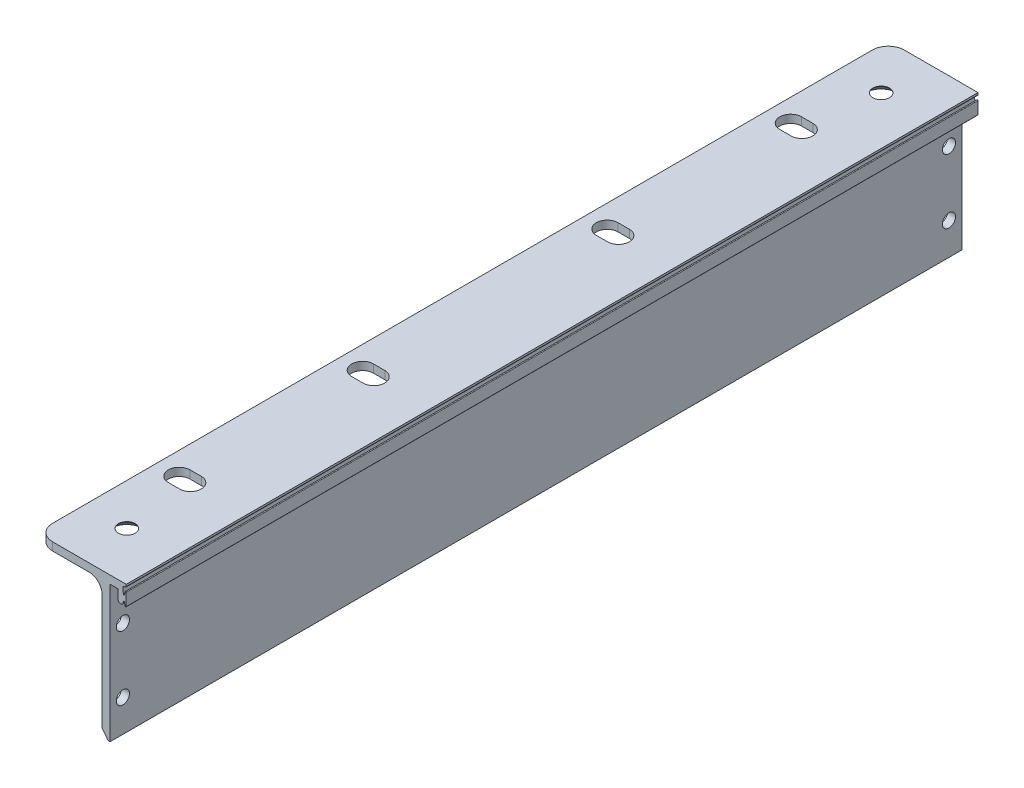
SolidWorks part; units mm, degrees
ref_plane "前视基准面" through (0, 0, 0) normal (0, 0, 1) x (1, 0, 0)
ref_plane "上视基准面" through (0, 0, 0) normal (0, 1, 0) x (1, 0, 0)
ref_plane "右视基准面" through (0, 0, 0) normal (1, 0, 0) x (0, 0, -1)
sketch "草图1" plane through (0, 0, 0) normal (0, 0, 1) x (1, 0, 0)
  line L1 (2137.4351, -3066.2715) -> (2137.4351, -3069.1377)
  line L2 (2139.9751, -3063.7715) -> (2139.9751, -3064.3461)
  line L886 (2138.9752, -3069.3427) -> (2139.1203, -3068.8072)
  line L887 (2137.4351, -3066.2715) -> (2137.4351, -3069.1377)
  line L888 (2134.9351, -3066.2715) -> (2137.4351, -3066.2715)
  line L889 (2139.4107, -3068.8105) -> (2139.6548, -3069.798)
  line L890 (2134.9351, -3066.2715) -> (2134.9351, -3108.7715)
  line L891 (2134.9351, -3108.7715) -> (2134.3351, -3108.7715)
  line L892 (2139.9751, -3065.934) -> (2139.9751, -3069.759)
  line L893 (2132.4351, -3106.2715) -> (2134.3351, -3108.7715)
  line L894 (2132.4351, -3070.2715) -> (2132.4351, -3106.2715)
  line L895 (2139.4107, -3066.8825) -> (2139.6548, -3065.895)
  line L896 (2112.0351, -3066.2715) -> (2128.4351, -3066.2715)
  line L897 (2112.0351, -3063.7715) -> (2112.0351, -3066.2715)
  line L898 (2112.0351, -3063.7715) -> (2139.9751, -3063.7715)
  line L899 (2139.9751, -3063.7715) -> (2139.9751, -3064.3461)
  line L900 (2139.174, -3064.7312) -> (2139.723, -3064.6423)
  arc A123 (2137.4351, -3069.1377) -> (2138.9752, -3069.3427) centre (2138.2188, -3069.1377) ccw
  arc A124 (2139.4107, -3068.8105) -> (2139.1203, -3068.8072) centre (2139.2651, -3068.8465) ccw
  arc A125 (2139.6548, -3069.798) -> (2139.9751, -3069.759) centre (2139.8126, -3069.759) ccw
  arc A126 (2139.9751, -3065.934) -> (2139.6548, -3065.895) centre (2139.8126, -3065.934) ccw
  arc A127 (2139.1161, -3066.864) -> (2139.4107, -3066.8825) centre (2139.2651, -3066.8465) ccw
  arc A128 (2138.9221, -3065.0153) -> (2139.1161, -3066.864) centre (2145.3632, -3065.274) ccw
  arc A129 (2139.174, -3064.7312) -> (2138.9221, -3065.0153) centre (2139.2219, -3065.0273) ccw
  arc A130 (2139.723, -3064.6423) -> (2139.9751, -3064.3461) centre (2139.6751, -3064.3461) ccw
  arc A131 (2132.4351, -3070.2715) -> (2128.4351, -3066.2715) centre (2128.4351, -3070.2715) ccw
extrude "凸台-拉伸1" add sketch "草图1" along normal mid plane 265.35 contours A131 L894 L893 L891 L890 L888 L1 A123 L886 A124 L889 A125 L892 A126 L895 A127 A128 A129 L900 A130 L2 L898 L897 L896
sketch "草图8" plane through (2132.4351, 0, 0) normal (-1, 0, 0) x (0, 0, 1)
  line L0 (-132.675, -3070.2715) -> (-132.675, -3106.2715) construction
  line L1 (132.675, -3063.7715) -> (-132.675, -3063.7715) construction
  line L2 (0, -3106.2715) -> (0, -3066.2715) construction
  line L3 (132.675, -3106.2715) -> (-132.675, -3106.2715) construction
  line L4 (132.675, -3066.2715) -> (-132.675, -3066.2715) construction
  circle A0 centre (-128.675, -3078.7715) radius 2.05
  circle A1 centre (-128.675, -3098.7715) radius 2.05
  circle A2 centre (128.675, -3098.7715) radius 2.05
  circle A3 centre (128.675, -3078.7715) radius 2.05
  dimension "D1" = 4.1
  dimension "D2" = 4.1
  dimension "D3" = 4
  dimension "D4" = 20
  dimension "D5" = 4
  dimension "D6" = 15
extrude "切除-拉伸7" cut sketch "草图8" against normal blind 132
sketch "草图4" plane through (0, -3063.7715, 0) normal (0, 1, 0) x (1, 0, 0)
  line L0 (2119.0351, 95.25) -> (2122.5351, 95.25) construction
  line L1 (2112.0351, 132.675) -> (2139.9751, 132.675) construction
  line L2 (2119.0351, 98.65) -> (2122.5351, 98.65)
  line L3 (2119.0351, 91.85) -> (2122.5351, 91.85)
  line L4 (2112.0351, -132.675) -> (2112.0351, 132.675) construction
  line L5 (2139.9751, 0) -> (2112.0351, 0) construction
  line L6 (2139.9751, -132.675) -> (2139.9751, 132.675) construction
  line L7 (2119.0351, -95.25) -> (2122.5351, -95.25) construction
  line L8 (2119.0351, -98.65) -> (2122.5351, -98.65)
  line L9 (2119.0351, -91.85) -> (2122.5351, -91.85)
  arc A0 (2119.0351, 98.65) -> (2119.0351, 91.85) centre (2119.0351, 95.25) ccw
  arc A1 (2122.5351, 91.85) -> (2122.5351, 98.65) centre (2122.5351, 95.25) ccw
  arc A2 (2119.0351, -98.65) -> (2119.0351, -91.85) centre (2119.0351, -95.25) cw
  arc A3 (2122.5351, -91.85) -> (2122.5351, -98.65) centre (2122.5351, -95.25) cw
  point P4 (2120.7851, 95.25)
  point P17 (2120.7851, -95.25)
  dimension "D1" = 3.4
  dimension "D3" = 37.425
  dimension "D2" = 3.5
  dimension "D4" = 8.75
extrude "切除-拉伸2" cut sketch "草图4" against normal blind 132
sketch "草图7" plane through (0, -3063.7715, 0) normal (0, 1, 0) x (1, 0, 0)
  line L1 (2112.0351, -132.675) -> (2112.0351, 132.675) construction
  line L2 (2139.9751, 0) -> (2112.0351, 0) construction
  line L3 (2139.9751, -132.675) -> (2139.9751, 132.675) construction
  line L4 (2119.0351, 38.1) -> (2122.5351, 38.1) construction
  line L5 (2119.0351, -38.1) -> (2122.5351, -38.1) construction
  line L6 (2119.0351, 41.5) -> (2122.5351, 41.5)
  line L7 (2119.0351, 34.7) -> (2122.5351, 34.7)
  line L8 (2119.0351, -41.5) -> (2122.5351, -41.5)
  line L9 (2119.0351, -34.7) -> (2122.5351, -34.7)
  arc A2 (2119.0351, 41.5) -> (2119.0351, 34.7) centre (2119.0351, 38.1) ccw
  arc A3 (2122.5351, 34.7) -> (2122.5351, 41.5) centre (2122.5351, 38.1) ccw
  arc A4 (2119.0351, 98.65) -> (2119.0351, 91.85) centre (2119.0351, 95.25) ccw construction
  arc A5 (2119.0351, -41.5) -> (2119.0351, -34.7) centre (2119.0351, -38.1) cw
  arc A6 (2122.5351, -34.7) -> (2122.5351, -41.5) centre (2122.5351, -38.1) cw
  point P16 (2120.7851, 38.1)
  point P24 (2120.7851, -38.1)
  dimension "D4" = 3.4
  dimension "D6" = 57.15
  dimension "D7" = 3.5
  dimension "D5" = 8.75
extrude "切除-拉伸6" cut sketch "草图7" against normal blind 132
sketch "草图9" plane through (2132.4351, 0, 0) normal (-1, 0, 0) x (0, 0, 1)
  line L0 (-132.675, -3070.2715) -> (-132.675, -3106.2715) construction
  line L1 (132.675, -3063.7715) -> (-132.675, -3063.7715) construction
  circle A0 centre (-4.675, -3078.7715) radius 2.05
  circle A1 centre (4.675, -3078.7715) radius 2.05
  circle A2 centre (4.675, -3098.7715) radius 2.05
  circle A3 centre (-4.675, -3098.7715) radius 2.05
  dimension "D1" = 4.1
  dimension "D2" = 128
  dimension "D3" = 15
  dimension "D4" = 2
  dimension "D5" = 2
extrude "切除-拉伸8" cut sketch "草图9" against normal blind 132
fillet "圆角1" radius 5 2 edges at (2112.0351, -3065.0215, -132.675) (2112.0351, -3065.0215, 132.675)
sketch "草图11" plane through (0, -3063.7715, 0) normal (0, 1, 0) x (1, 0, 0)
  line L0 (2112.0351, -127.675) -> (2112.0351, 127.675) construction
  line L1 (2117.0351, 132.675) -> (2139.9751, 132.675) construction
  line L2 (2139.9751, 0) -> (2112.0351, 0) construction
  line L3 (2139.9751, -132.675) -> (2139.9751, 132.675) construction
  circle A0 centre (2122.0351, 111.175) radius 2.1
  circle A1 centre (2122.0351, -111.175) radius 2.1
  point P4 (2128.5051, 132.675)
  dimension "D1" = 4.2
  dimension "D2" = 10
  dimension "D3" = 21.5
extrude "切除-拉伸10" [suppressed] cut sketch "草图11" against normal through all
sketch "草图12" plane through (2132.4351, 0, 0) normal (-1, 0, 0) x (0, 0, 1)
  line L1 (10.9556, -3073.8244) -> (-12.9495, -3073.8244)
  line L2 (10.9556, -3073.8244) -> (10.9556, -3102.903)
  line L3 (10.9556, -3102.903) -> (-12.9495, -3102.903)
  line L4 (-12.9495, -3073.8244) -> (-12.9495, -3102.903)
extrude "凸台-拉伸2" add sketch "草图12" against normal up to surface (2.5 mm away)
hole_wizard "Ø5.2 (5.2) 直径孔1" positions "草图14" profile "草图13" hole size "Ø5.2" standard "Ansi Metric"
sketch "草图14" plane through (0, -3063.7715, 0) normal (0, 1, 0) x (1, 0, 0)
  line L0 (2139.9751, -132.675) -> (2139.9751, 132.675) construction
  line L1 (2112.0351, -127.675) -> (2112.0351, 127.675) construction
  line L2 (2112.0351, 0) -> (2139.9751, 0) construction
  point P0 (2124.9751, 117.5)
  point P12 (2124.9751, -117.5)
  dimension "D1" = 15
  dimension "D2" = 117.5
sketch "草图13" plane through (2124.9751, -3063.7715, -117.5) normal (1, 0, 0) x (0, 0, 1)
  line L0 (0, 0) -> (0, 7.3022)
  line L1 (0, 7.3022) -> (2.6, 5.74)
  line L2 (2.6, 5.74) -> (2.6, 0)
  line L5 (2.6, 0) -> (0, 0)
  line L10 (0, 7.3022) -> (-2.6, 5.74) construction
  line L11 (0, -6.35) -> (0, 107.95) construction
  dimension "孔直径" = 5.2
  dimension "孔深度" = 5.74
  dimension "导头角度" = 118
chamfer "倒角1" distance 2.4 angle 45 2 edges at (2122.3751, -3066.2715, 117.5) (2122.3751, -3066.2715, -117.5)
equation "\"切除-拉伸1\" = if ( \"D1@凸台-拉伸1\" = 132 , \"unsuppressed\" , \"suppressed\" )"
equation "\"切除-拉伸6\" = if ( \"D1@凸台-拉伸1\" = 265.35 , \"unsuppressed\" , \"suppressed\" )"
equation "\"切除-拉伸8\" = if ( \"D1@凸台-拉伸1\" = 265.35 , \"unsuppressed\" , \"suppressed\" )"
equation "\"切除-拉伸10\" = if ( \"D1@凸台-拉伸1\" = 176.45 , \"unsuppressed\" , \"suppressed\" )"
